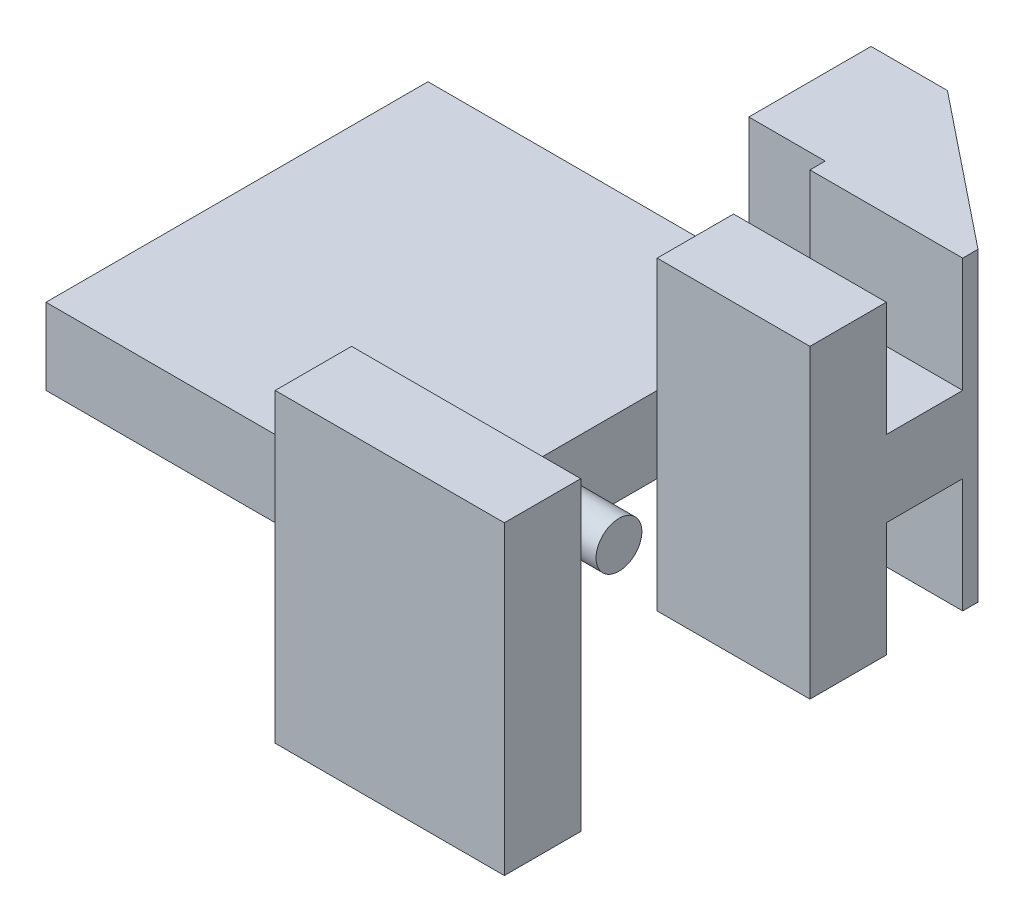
SolidWorks part; units mm, degrees
ref_plane "Front Plane" through (0, 0, 0) normal (0, 0, 1) x (1, 0, 0)
ref_plane "Top Plane" through (0, 0, 0) normal (0, 1, 0) x (1, 0, 0)
ref_plane "Right Plane" through (0, 0, 0) normal (1, 0, 0) x (0, 0, -1)
sketch "Sketch1" plane through (0, 0, 0) normal (0, 1, 0) x (1, 0, 0)
  line L2 (-25, 17.5) -> (-25, -7.5)
  line L4 (-25, 17.5) -> (-5, 17.5)
  line L7 (10, 18.5) -> (10, 7.5)
  line L8 (10, 7.5) -> (0, 7.5)
  line L9 (-25, -7.5) -> (-5, -7.5)
  line L10 (-5, -7.5) -> (-5, -12.5)
  line L11 (-5, -12.5) -> (10, -12.5)
  line L12 (10, -12.5) -> (10, -7.5)
  line L13 (10, -7.5) -> (0, -7.5)
  line L15 (-5, 26.5) -> (0, 26.5)
  line L16 (0, 26.5) -> (10, 18.5)
  line L17 (-5, 26.5) -> (-5, 17.5)
  line L18 (0, -7.5) -> (0, 0)
  line L19 (0, 7.5) -> (0, 0)
  point P4 (0, 0)
  dimension "D1" = 10
  dimension "D2" = 20
  dimension "D3" = 25
  dimension "D4" = 11
  dimension "D5" = 5
  dimension "D6" = 15
  dimension "D7" = 8
  dimension "D8" = 10
  dimension "D9" = 5
extrude "Boss-Extrude1" add sketch "Sketch1" along normal mid plane 20
sketch "Sketch2" plane through (0, 0, 0) normal (1, 0, 0) x (0, 0, -1)
  line L0 (0, 2.5) -> (0, -2.5) construction
  line L7 (-7.5, -2.5) -> (-7.5, -10)
  line L10 (-7.5, 2.5) -> (-7.5, 10)
  line L16 (18.5, 10) -> (18.5, -10) construction
  line L17 (18.5, 2.5) -> (18.5, 10)
  line L20 (7.5, -10) -> (18.5, -10) construction
  line L22 (18.5, -2.5) -> (18.5, -10)
  line L24 (-7.5, 10) -> (-7.5, -10) construction
  line L28 (-7.5, -10) -> (18.5, -10)
  line L29 (18.5, -2.5) -> (-7.5, -2.5)
  line L30 (-7.5, 2.5) -> (18.5, 2.5)
  line L31 (-7.5, 10) -> (18.5, 10)
  point P7 (0, 0)
  dimension "D1" = 5
extrude "Cut-Extrude1" cut sketch "Sketch2" against normal up to surface (25 mm away)
sketch "Sketch4" plane through (0, 0, 0) normal (-1, 0, 0) x (0, 0, 1)
  line L1 (-7.5, 2.5) -> (-18.5, 2.5) construction
  line L13 (-7.5, 10) -> (-12.5, 10) construction
  line L14 (-7.5, 10) -> (-18.5, 10) construction
  line L15 (-12.5, 10) -> (-17.5, 10)
  line L16 (-17.5, 10) -> (-17.5, 2.5)
  line L17 (-17.5, 2.5) -> (-12.5, 2.5)
  line L18 (-17.5, 2.5) -> (7.5, 2.5) construction
  line L19 (-12.5, 2.5) -> (-12.5, 10)
  line L21 (-17.5, -2.5) -> (-12.5, -2.5)
  line L22 (-18.5, -2.5) -> (-7.5, -2.5) construction
  line L23 (-12.5, -2.5) -> (-12.5, -10)
  line L24 (-7.5, -10) -> (-18.5, -10) construction
  line L25 (-12.5, -10) -> (-17.5, -10)
  line L26 (-17.5, -10) -> (-17.5, -2.5)
  dimension "D1" = 5
  dimension "D2" = 5
extrude "Cut-Extrude3" cut sketch "Sketch4" against normal blind 10
sketch "Sketch5" plane through (0, 0, 0) normal (1, 0, 0) x (0, 0, -1)
  circle A0 centre (0, 0) radius 1.5
  dimension "D1" = 3
extrude "Boss-Extrude3" add sketch "Sketch5" along normal blind 5
